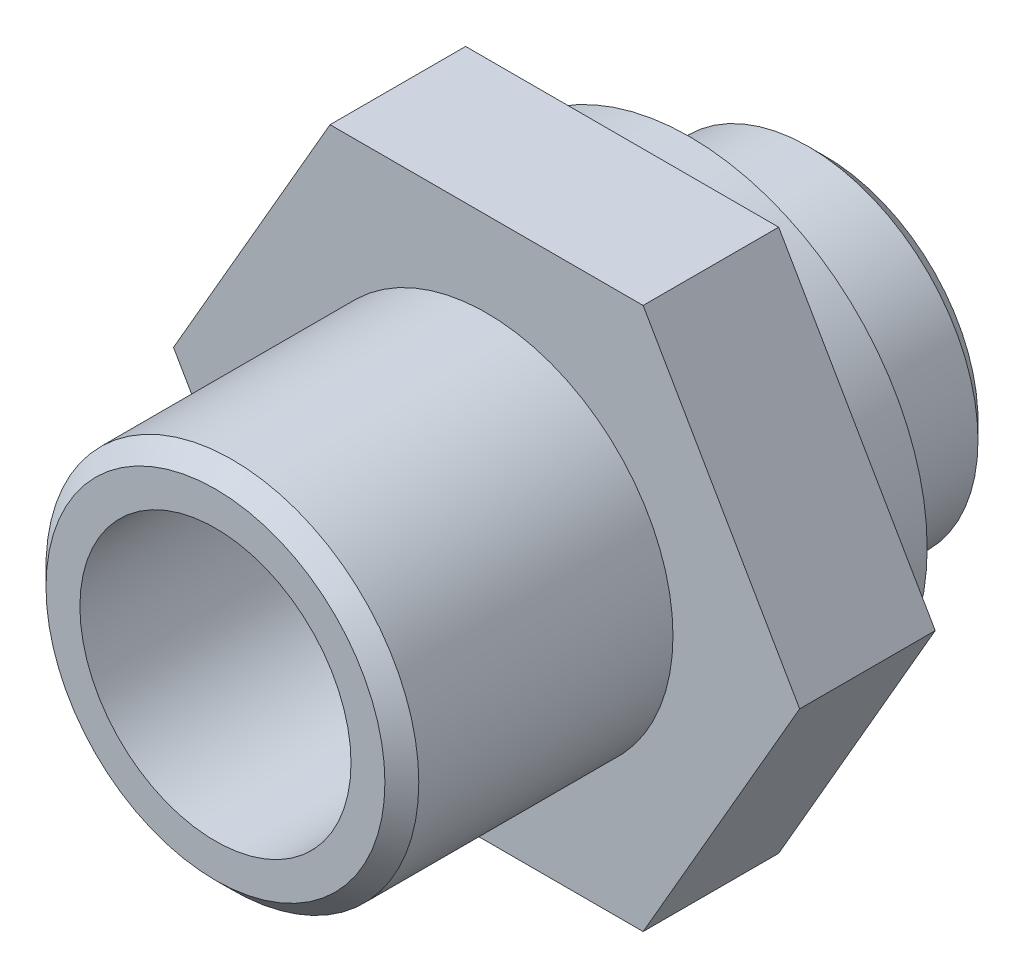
SolidWorks part; units mm, degrees
ref_plane "Front Plane" through (0, 0, 0) normal (0, 0, 1) x (1, 0, 0)
ref_plane "Top Plane" through (0, 0, 0) normal (0, 1, 0) x (1, 0, 0)
ref_plane "Right Plane" through (0, 0, 0) normal (1, 0, 0) x (0, 0, -1)
sketch "Sketch1" plane through (0, 0, 0) normal (0, 0, 1) x (1, 0, 0)
  line L0 (0, 0) -> (0, -3422.6713) construction
  line L1 (0, 0) -> (3422.6713, 0) construction
  line L3 (-4.6188, 0) -> (-2.3094, -4)
  line L4 (-2.3094, -4) -> (2.3094, -4)
  line L5 (2.3094, -4) -> (4.6188, 0)
  line L6 (4.6188, 0) -> (2.3094, 4)
  line L7 (2.3094, 4) -> (-2.3094, 4)
  line L8 (-2.3094, 4) -> (-4.6188, 0)
  circle A0 centre (0, 0) radius 4 construction
  point P6 (0, 0)
  dimension "D1" = 8
extrude "Boss-Extrude1" add sketch "Sketch1" along normal blind 2
sketch "Sketch2" plane through (0, 0, 2) normal (0, 0, 1) x (1, 0, 0)
  circle A0 centre (0, 0) radius 2.75
  dimension "D1" = 5.5
extrude "Boss-Extrude2" add sketch "Sketch2" along normal blind 4
sketch "Sketch3" plane through (0, 0, 0) normal (0, 0, -1) x (-1, 0, 0)
  circle A0 centre (0, 0) radius 3.5
  dimension "D1" = 7
extrude "Boss-Extrude3" add sketch "Sketch3" along normal blind 1
sketch "Sketch4" plane through (0, 0, -1) normal (0, 0, -1) x (-1, 0, 0)
  circle A0 centre (0, 0) radius 2.5
  dimension "D1" = 5
extrude "Boss-Extrude4" add sketch "Sketch4" along normal blind 2
sketch "Sketch5" plane through (0, 0, -3) normal (0, 0, -1) x (-1, 0, 0)
  circle A0 centre (0, 0) radius 2
  dimension "D1" = 4
extrude "Cut-Extrude1" cut sketch "Sketch5" against normal blind 10
chamfer "Chamfer1" distance 0.25 angle 45 2 edges at (2.75, 0, 6) (-2.5, 0, -3)
